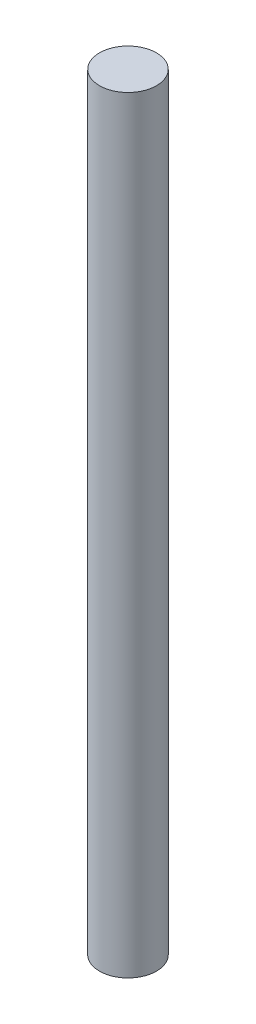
SolidWorks part; units mm, degrees
ref_plane "Front Plane" through (0, 0, 0) normal (0, 0, 1) x (1, 0, 0)
ref_plane "Top Plane" through (0, 0, 0) normal (0, 1, 0) x (1, 0, 0)
ref_plane "Right Plane" through (0, 0, 0) normal (1, 0, 0) x (0, 0, -1)
sketch "Sketch1" plane through (0, 0, 0) normal (0, 1, 0) x (1, 0, 0)
  circle A0 centre (0, 0) radius 1.651
extrude "Boss-Extrude2" add sketch "Sketch1" along normal blind 44.45
